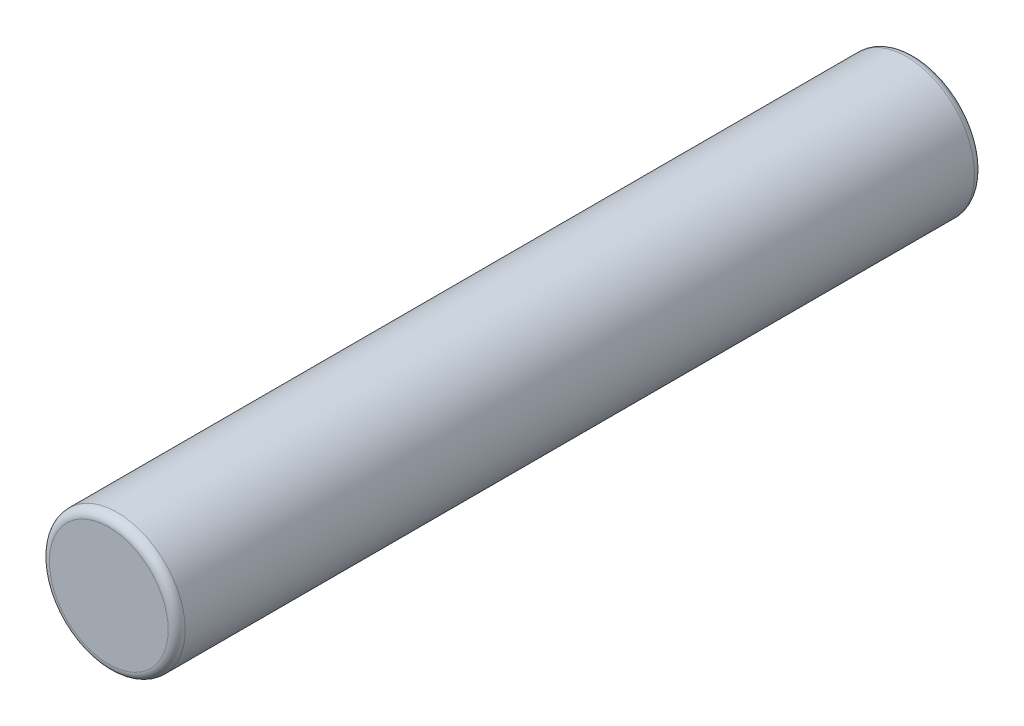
SolidWorks part; units mm, degrees
ref_plane "正面" through (0, 0, 0) normal (0, 0, 1) x (1, 0, 0)
ref_plane "平面" through (0, 0, 0) normal (0, 1, 0) x (1, 0, 0)
ref_plane "右側面" through (0, 0, 0) normal (1, 0, 0) x (0, 0, -1)
sketch "ｽｹｯﾁ1" plane through (0, 0, 0) normal (0, 0, 1) x (1, 0, 0)
  circle A0 centre (0, 0) radius 0.8
  dimension "D1" = 1.6
extrude "ﾎﾞｽ - 押し出し1" add sketch "ｽｹｯﾁ1" along normal blind 9.5
fillet "ﾌｨﾚｯﾄ1" radius 0.1 2 edges at (0.8, 0, 0) (0.8, 0, 9.5)
